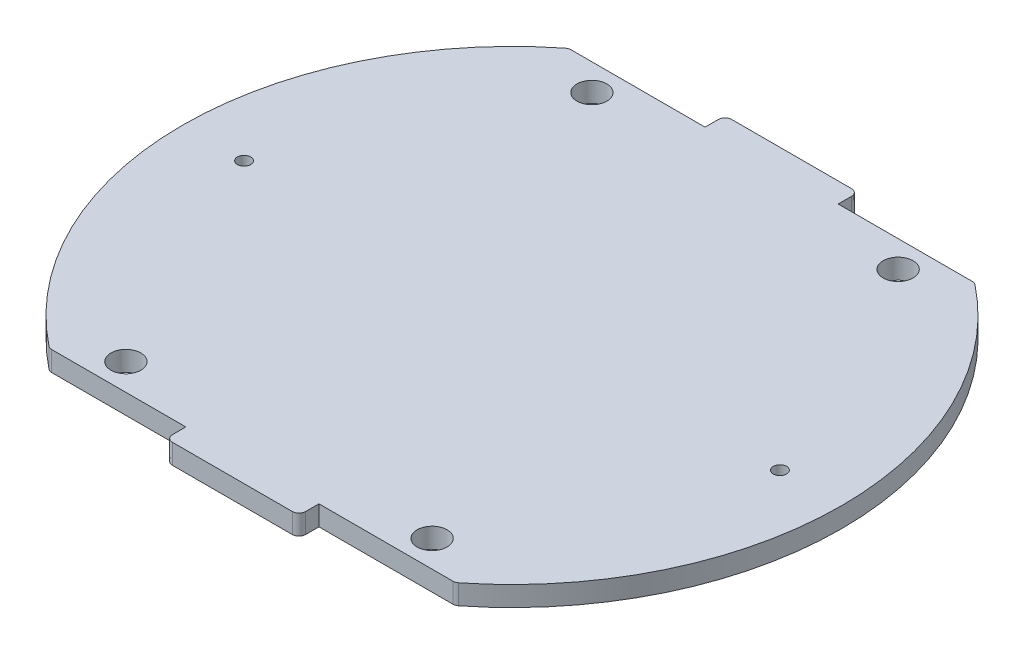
SolidWorks part; units mm, degrees
other "<a_base_t42>-<#8 Clearance Hole1>"
ref_plane "Front Plane" through (0, 0, 0) normal (0, 0, 1) x (1, 0, 0)
ref_plane "Top Plane" through (0, 0, 0) normal (0, 1, 0) x (1, 0, 0)
ref_plane "Right Plane" through (0, 0, 0) normal (1, 0, 0) x (0, 0, -1)
inserted part "a_base_t42"
sketch "Sketch1" plane through (0, 0, 0) normal (0, -1, 0) x (1, 0, 0)
  line L0 (30.4836, 39) -> (-30.4836, 39)
  line L1 (-30.4836, -39) -> (30.4836, -39)
  line L2 (31.5, 42) -> (-31.5, 42)
  line L3 (-31.5, -42) -> (31.5, -42)
  line L4 (31.5, 42) -> (-31.5, 42)
  line L5 (-31.5, -42) -> (31.5, -42)
  arc A0 (-30.4836, 39) -> (-30.4836, -39) centre (0, 0) ccw
  arc A1 (30.4836, -39) -> (30.4836, 39) centre (0, 0) ccw
  arc A2 (31.5, -42) -> (31.5, 42) centre (0, 0) ccw
  arc A3 (-31.5, 42) -> (-31.5, -42) centre (0, 0) ccw
  arc A4 (31.5, -42) -> (31.5, 42) centre (0, 0) ccw
  arc A5 (-31.5, 42) -> (-31.5, -42) centre (0, 0) ccw
  dimension "D1" = 0
  dimension "D2" = 3
extrude "Outer Rim Cut" cut sketch "Sketch1" against normal through all
sketch "Sketch2" plane through (0, 0, 0) normal (0, -1, 0) x (1, 0, 0)
  line L0 (0, 39) -> (0, 0) construction
  line L1 (30.4836, 39) -> (-30.4836, 39) construction
  line L2 (0, 0) -> (49.5, 0) construction
  line L3 (-10, -39) -> (-10, -42)
  line L4 (-10, 39) -> (10, 39)
  line L5 (-10, 39) -> (-10, 42)
  line L6 (-10, 42) -> (10, 42)
  line L7 (10, 39) -> (10, 42)
  line L8 (-10, -39) -> (10, -39)
  line L9 (10, -39) -> (10, -42)
  line L10 (-10, -42) -> (10, -42)
  arc A0 (30.4836, -39) -> (30.4836, 39) centre (0, 0) ccw construction
  dimension "D1" = 20
  dimension "D2" = 3
extrude "Flanges" add sketch "Sketch2" against normal up to surface (3 mm away)
fillet "Contouring" radius 1 8 edges at (30.4836, 1.5, -39) (-30.4836, 1.5, -39) (10, 1.5, -42) (-10, 1.5, -42) (30.4836, 1.5, 39) (-30.4836, 1.5, 39) (10, 1.5, 42) (-10, 1.5, 42)
sketch "Sketch3" plane through (0, 0, 0) normal (0, -1, 0) x (1, 0, 0)
  line L0 (0, 42) -> (0, 0) construction
  line L1 (9, 42) -> (-9, 42) construction
  line L2 (0, 0) -> (49.5, 0) construction
  line L3 (-7.5, -28.5) -> (-7.5, -25.5)
  line L4 (-7.5, 28.5) -> (7.5, 28.5)
  line L5 (-7.5, 28.5) -> (-7.5, 25.5)
  line L6 (-7.5, 25.5) -> (7.5, 25.5)
  line L7 (7.5, 28.5) -> (7.5, 25.5)
  line L8 (-7.5, -28.5) -> (7.5, -28.5)
  line L9 (7.5, -28.5) -> (7.5, -25.5)
  line L10 (-7.5, -25.5) -> (7.5, -25.5)
  arc A0 (30.7586, -38.7835) -> (30.7586, 38.7835) centre (0, 0) ccw construction
  dimension "D1" = 15
  dimension "D2" = 3
  dimension "D3" = 25.5
extrude "Base Supports" add sketch "Sketch3" along normal blind 3
chamfer "Base Supports Chamfer" distance 3 angle 45 2 edges at (0, 0, -28.5) (0, 0, 28.5)
ref_point "Point1"
sketch "Sketch4" [suppressed] plane through (0, 0, 0) normal (0, -1, 0) x (1, 0, 0)
  line L0 (0, 42) -> (0, 0) construction
  line L1 (9, 42) -> (-9, 42) construction
  line L2 (0, 0) -> (-49.5, 0) construction
  line L4 (-34, 22.5) -> (-31, 22.5)
  line L5 (-34, 22.5) -> (-34, -22.5)
  line L6 (-34, -22.5) -> (-31, -22.5)
  line L7 (-31, 22.5) -> (-31, -22.5)
  line L8 (34, 22.5) -> (34, -22.5)
  line L9 (34, -22.5) -> (31, -22.5)
  line L10 (31, 22.5) -> (31, -22.5)
  line L11 (34, 22.5) -> (31, 22.5)
  line L12 (-7.5, 28.5) -> (-7.5, 25.5) construction
  arc A0 (-30.7586, 38.7835) -> (-30.7586, -38.7835) centre (0, 0) ccw construction
  dimension "D1" = 45
  dimension "D2" = 62
extrude "Dynamixel Side Supports" [suppressed] add sketch "Sketch4" along normal blind 6.85
sketch "Sketch5" [suppressed] plane through (0, 0, 0) normal (0, -1, 0) x (1, 0, 0)
  line L1 (-34, 22.5) -> (-22, 22.5)
  line L2 (-34, 22.5) -> (-34, 25.5)
  line L3 (-34, 25.5) -> (-22, 25.5)
  line L4 (-22, 22.5) -> (-22, 25.5)
  line L5 (34, -22.5) -> (22, -22.5)
  line L6 (34, -22.5) -> (34, -25.5)
  line L7 (34, -25.5) -> (22, -25.5)
  line L8 (22, -22.5) -> (22, -25.5)
  line L9 (-7.5, 28.5) -> (-7.5, 25.5) construction
  dimension "D1" = 12
extrude "Dynamixel Side Support Ends" [suppressed] add sketch "Sketch5" along normal blind 9.85
sketch "Sketch8" [suppressed] plane through (0, 0, 0) normal (0, -1, 0) x (1, 0, 0)
  line L0 (0, 42) -> (0, 0) construction
  line L1 (-31, -22.5) -> (-22, -22.5)
  line L2 (-31, -22.5) -> (-31, 22.5)
  line L3 (-31, 22.5) -> (-22, 22.5)
  line L4 (-22, -22.5) -> (-22, 22.5)
  line L5 (9, 42) -> (-9, 42) construction
  line L6 (22, -22.5) -> (22, 22.5)
  line L7 (31, 22.5) -> (22, 22.5)
  line L8 (31, -22.5) -> (31, 22.5)
  line L9 (31, -22.5) -> (22, -22.5)
extrude "Dynamixel Offset" [suppressed] add sketch "Sketch8" along normal blind 1.25
fillet "Dynamixel Contouring" [suppressed] radius 1
sketch "Sketch6" [suppressed] plane through (0, 0, 0) normal (0, -1, 0) x (1, 0, 0)
  line L0 (0, 42) -> (0, 0) construction
  line L1 (9, 42) -> (-9, 42) construction
  line L2 (0, 0) -> (-49.5, 0) construction
  line L3 (33.75, 27.82) -> (28.75, 27.82)
  line L4 (-33.75, 27.82) -> (-28.75, 27.82)
  line L5 (-33.75, 27.82) -> (-33.75, -27.82)
  line L6 (-33.75, -27.82) -> (-28.75, -27.82)
  line L7 (-28.75, 27.82) -> (-28.75, -27.82)
  line L8 (33.75, 27.82) -> (33.75, -27.82)
  line L9 (33.75, -27.82) -> (28.75, -27.82)
  line L10 (28.75, 27.82) -> (28.75, -27.82)
  arc A0 (-30.7586, 38.7835) -> (-30.7586, -38.7835) centre (0, 0) ccw construction
  dimension "D1" = 5
  dimension "D2" = 57.5
  dimension "D3" = 55.64
extrude "Servo Side Supports" [suppressed] add sketch "Sketch6" along normal blind 8.5
sketch "Sketch7" [suppressed] plane through (0, -8.5, 0) normal (0, -1, 0) x (1, 0, 0)
  line L0 (-28.75, -27.82) -> (-28.75, 27.82) construction
  line L1 (-33.75, 27.82) -> (-28.75, 27.82)
  line L2 (-33.75, 27.82) -> (-33.75, 20)
  line L3 (-33.75, 20) -> (-28.75, 20)
  line L4 (-28.75, 27.82) -> (-28.75, 20)
  line L5 (-62.1115, 0) -> (0, 0) construction
  line L6 (0, 0) -> (0, 52.5269) construction
  line L7 (28.75, 27.82) -> (28.75, 20)
  line L8 (33.75, 20) -> (28.75, 20)
  line L9 (33.75, 27.82) -> (33.75, 20)
  line L10 (33.75, 27.82) -> (28.75, 27.82)
  line L11 (33.75, -27.82) -> (28.75, -27.82)
  line L12 (33.75, -27.82) -> (33.75, -20)
  line L13 (33.75, -20) -> (28.75, -20)
  line L14 (28.75, -27.82) -> (28.75, -20)
  line L15 (-28.75, -27.82) -> (-28.75, -20)
  line L16 (-33.75, -20) -> (-28.75, -20)
  line L17 (-33.75, -27.82) -> (-33.75, -20)
  line L18 (-33.75, -27.82) -> (-28.75, -27.82)
  dimension "D1" = 40
extrude "Servo Side Support Ends" [suppressed] add sketch "Sketch7" along normal blind 5
fillet "Servo Contouring" [suppressed] radius 1
equation "\"D2@Sketch1\"=\"width keep@values@params_print.SLDPRT\""
equation "\"D2@Sketch2\"=\"width keep@values@params_print.SLDPRT\""
equation "\"D2@Sketch3\"=\"width keep@values@params_print.SLDPRT\""
equation "\"D1@Base Supports\"=\"width keep@values@params_print.SLDPRT\""
equation "\"D1@Base Supports Chamfer\"=\"width keep@values@params_print.SLDPRT\""
